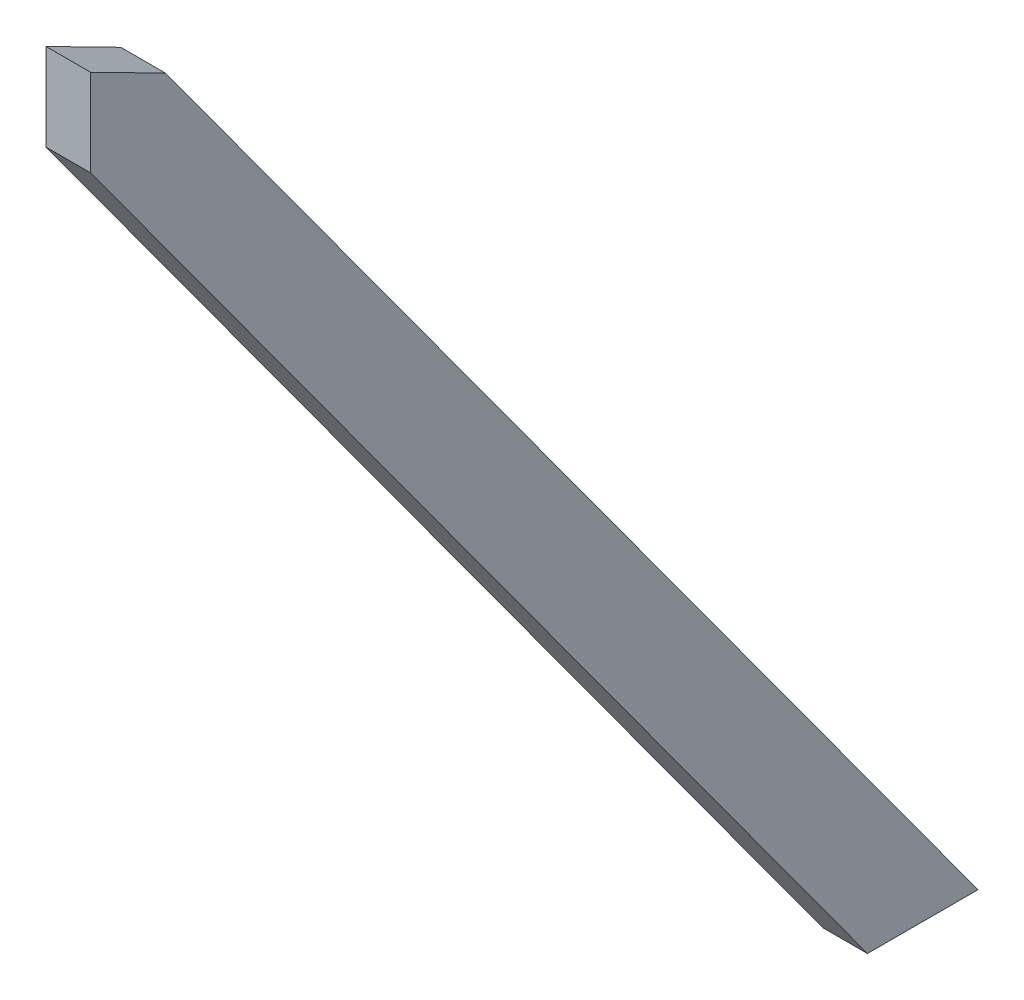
SolidWorks part; units mm, degrees
ref_plane "Face" through (0, 0, 0) normal (0, 0, 1) x (1, 0, 0)
ref_plane "Dessus" through (0, 0, 0) normal (0, 1, 0) x (1, 0, 0)
ref_plane "Droite" through (0, 0, 0) normal (1, 0, 0) x (0, 0, -1)
sketch "Esquisse1" plane through (0, 0, 0) normal (1, 0, 0) x (0, 0, -1)
  line L0 (-49.833, 50.8193) -> (-49.833, 60.5753)
  line L1 (-49.833, 60.5753) -> (-41.4594, 56.3088)
  line L2 (37.1411, -68.3646) -> (-49.833, 50.8193)
  line L4 (49.5207, -68.3646) -> (-41.4594, 56.3088)
  line L5 (37.1411, -68.3646) -> (49.5207, -68.3646)
  dimension "D1" = 10
  dimension "D2" = 153.12
  dimension "D3" = 154.34
  dimension "D4" = 63
  dimension "D5" = 9.7561
  dimension "D6" = 9.3979
extrude "Extrusion1" add sketch "Esquisse1" along normal blind 5
